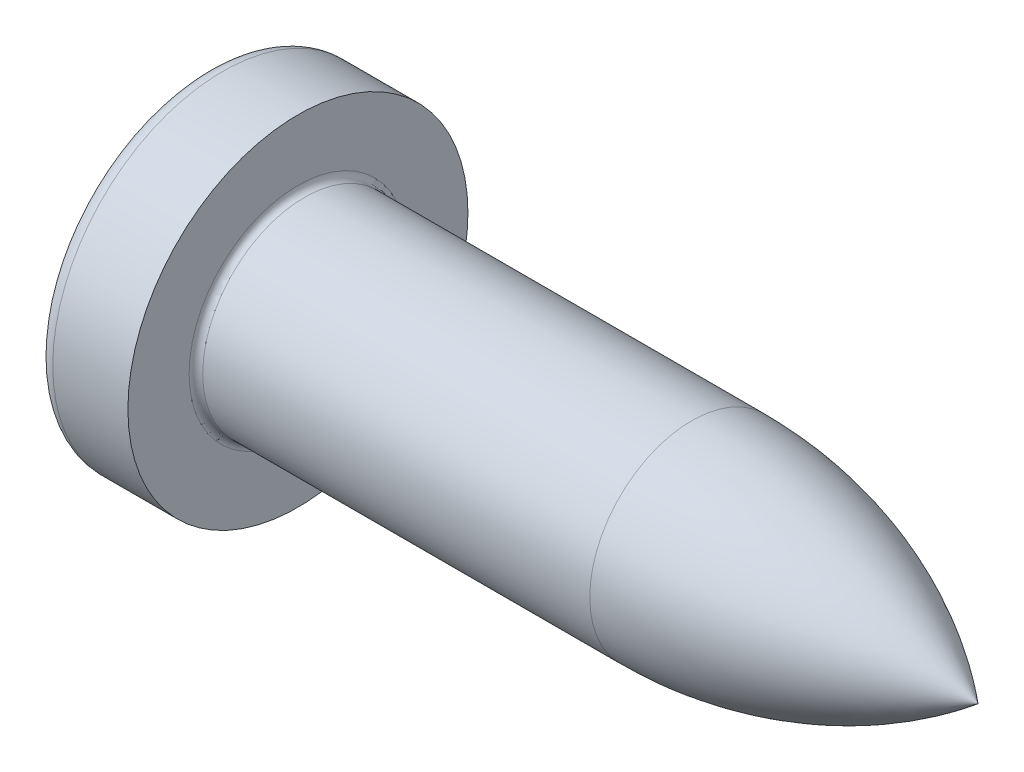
SolidWorks part; units mm, degrees
ref_plane "Plane1" through (0, 0, 0) normal (0, 0, 1) x (1, 0, 0)
ref_plane "Plane2" through (0, 0, 0) normal (0, 1, 0) x (1, 0, 0)
ref_plane "Plane3" through (0, 0, 0) normal (1, 0, 0) x (0, 0, -1)
revolve "Base-Revolve" add sketch "BodySke"
sketch "BodySke" plane through (0, 0, 0) normal (0, 0, 1) x (1, 0, 0)
  line L0 (2.1, 1.5) -> (2.1, 2.5)
  line L1 (2.325, 6.35) -> (2.325, -3.175) construction
  line L2 (-25.4, 0) -> (127, 0) construction
  line L3 (12.1, 0) -> (0, 0)
  line L4 (2.1, 1.5) -> (7.8913, 1.5)
  line L6 (0.995, 2.5) -> (2.1, 2.5)
  line L8 (2.1, 6.35) -> (2.1, -3.175) construction
  arc A0 (0.8032, 2.4043) -> (0, 0) centre (4, 0) ccw
  arc A1 (12.1, 0) -> (7.8913, 1.5) centre (7.8913, -5.1544) ccw
  arc A2 (0.8032, 2.4043) -> (0.995, 2.5) centre (0.995, 2.26) cw
  dimension "Head_fillet_rad" = 0.24
  dimension "Head_crown_rad" = 4
  dimension "D1" = 1.5
  dimension "D2" = 10
  dimension "Head_ht" = 2.1
  dimension "Head_dia" = 5
  dimension "Advance" = 0.45
fillet "Fillet1" radius 0.1 1 edges at (2.1, 0, 1.5)
sketch "Sketch3" plane through (0, 0, 0) normal (1, 0, 0) x (0, 0, -1)
  line L0 (0.37, -1.3) -> (-0.37, -1.3)
  line L1 (0.37, -1.3) -> (0.37, 1.3)
  line L2 (-0.37, 1.3) -> (0.37, 1.3)
  line L3 (-0.37, 1.3) -> (-0.37, -1.3)
  dimension "D1" = 1.3
  dimension "Cross_dia" = 2.6
  dimension "D2" = 0.37
  dimension "Cross_width" = 0.74
ref_plane "Plane4" through (1.5, 0, 0) normal (1, 0, 0) x (0, 0, -1)
sketch "Sketch4" plane through (1.5, 0, 0) normal (1, 0, 0) x (0, 0, -1)
  line L0 (0.37, -0.5521) -> (-0.37, -0.5521)
  line L1 (0.37, -0.5521) -> (0.37, 0.5521)
  line L2 (-0.37, 0.5521) -> (0.37, 0.5521)
  line L3 (-0.37, 0.5521) -> (-0.37, -0.5521)
  dimension "D1" = 0.74
  dimension "D2" = 1.1043
  dimension "D3" = 0.37
  dimension "D4" = 0.5521
loft "Recess" cut profiles "Sketch3", "Sketch4"
pattern_circular "RecPat" count 2 every 90 about axis through (0, 0, 0) along (1, 0, 0) of "Recess"
sketch "RecCorSke" plane through (0, 0, 0) normal (0, 0, 1) x (1, 0, 0)
  line L0 (-3.175, 0) -> (15.875, 0) construction
  line L1 (-25.4, 0) -> (127, 0) construction
  line L2 (0, 0) -> (0, 0.6609)
  line L3 (0, 0.6609) -> (1.5, 0.556)
  line L4 (1.5, 0.556) -> (1.6807, 0)
  line L5 (1.6807, 0) -> (0, 0)
  dimension "Diameter" = 1.112
  dimension "Depth" = 1.5
  dimension "Draft_angle" = 4
  dimension "Bottom_angle" = 18
revolve "RecessCore" cut sketch "RecCorSke" angle 360 about L0
sketch "ThdSchSke" plane through (0, 0, 0) normal (0, 0, 1) x (1, 0, 0)
  line L0 (3, -0.9965) -> (2.8225, -1.25)
  line L1 (3, -0.9965) -> (3.1775, -1.25)
  line L2 (3.1775, -1.25) -> (3.1775, -1.5625)
  line L3 (-3.175, 0) -> (5.1513, 0) construction
  line L5 (3.1775, -1.5625) -> (2.8225, -1.5625)
  line L6 (2.8225, -1.5625) -> (2.8225, -1.25)
  dimension "Thread_minor" = 1.993
  dimension "Diameter" = 2.5
  dimension "Start" = 3
  dimension "SideAngle" = 55
  dimension "VeeAngle" = 70
  dimension "Overcut" = 3.125
revolve "ThreadSchematic" cut sketch "ThdSchSke" angle 360 about L3
pattern_linear "ThdSchPat"
